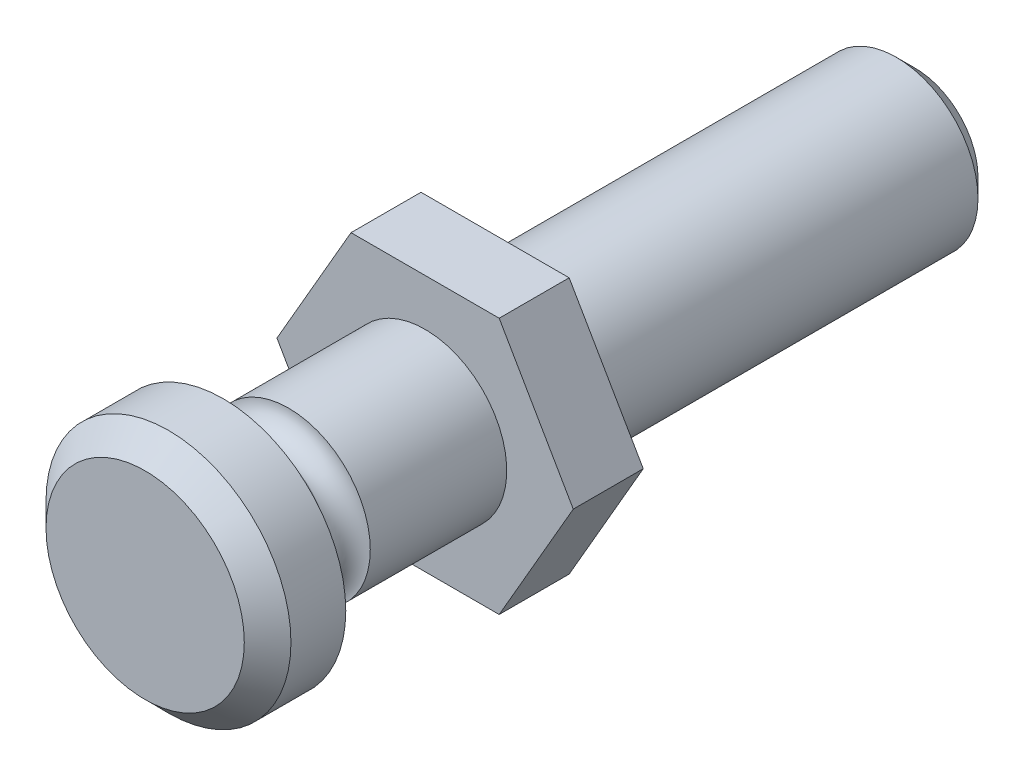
SolidWorks part; units mm, degrees
ref_plane "Plan1" through (0, 0, 0) normal (0, 0, 1) x (1, 0, 0)
ref_plane "Plan2" through (0, 0, 0) normal (0, 1, 0) x (1, 0, 0)
ref_plane "Plan3" through (0, 0, 0) normal (1, 0, 0) x (0, 0, -1)
sketch "Esquisse1" plane through (0, 0, 0) normal (0, 0, 1) x (1, 0, 0)
  circle A0 centre (0, 0) radius 3.5
  dimension "D1" = 7
extrude "Base-Extrusion" add sketch "Esquisse1" along normal blind 18
sketch "Esquisse2" plane through (0, 0, 18) normal (0, 0, 1) x (1, 0, 0)
  line L1 (6.3509, 0) -> (3.1754, 5.5)
  line L2 (3.1754, 5.5) -> (-3.1754, 5.5)
  line L3 (-3.1754, 5.5) -> (-6.3509, 0)
  line L4 (-6.3509, 0) -> (-3.1754, -5.5)
  line L5 (-3.1754, -5.5) -> (3.1754, -5.5)
  line L6 (3.1754, -5.5) -> (6.3509, 0)
  circle A0 centre (0, 0) radius 5.5 construction
  dimension "D1" = 11
extrude "Boss.-Extru.1" add sketch "Esquisse2" along normal blind 3
sketch "Esquisse3" plane through (0, 0, 21) normal (0, 0, 1) x (1, 0, 0)
  circle A0 centre (0, 0) radius 3.5
  dimension "D1" = 7
extrude "Boss.-Extru.2" add sketch "Esquisse3" along normal blind 5.85
sketch "Esquisse4" plane through (0, 0, 26.85) normal (0, 0, 1) x (1, 0, 0)
  circle A0 centre (0, 0) radius 2.6
  dimension "D1" = 5.2
extrude "Boss.-Extru.3" add sketch "Esquisse4" along normal blind 1.8
sketch "Esquisse5" plane through (0, 0, 28.65) normal (0, 0, 1) x (1, 0, 0)
  circle A0 centre (0, 0) radius 3.5
  dimension "D1" = 7
extrude "Boss.-Extru.4" add sketch "Esquisse5" along normal blind 1
fillet "Congé1" radius 0.9
sketch "Esquisse6" plane through (0, 0, 29.65) normal (0, 0, 1) x (1, 0, 0)
  circle A0 centre (0, 0) radius 5.25
  dimension "D1" = 10.5
extrude "Boss.-Extru.5" add sketch "Esquisse6" along normal blind 4.35
chamfer "Chanfrein1" distance 0.8 angle 45
sketch "Esquisse7" plane through (0, 0, 34) normal (0, 0, 1) x (1, 0, 0)
  circle A0 centre (0, 0) radius 5.25
  circle A1 centre (0, 0) radius 5.25 construction
extrude "Enlèv. mat.-Extru.1" cut sketch "Esquisse7" against normal blind 1
chamfer "Chanfrein2" distance 1 angle 45
ref_plane "Plan4" through (0, 0, 27.75) normal (0, 0, 1) x (1, 0, 0)
